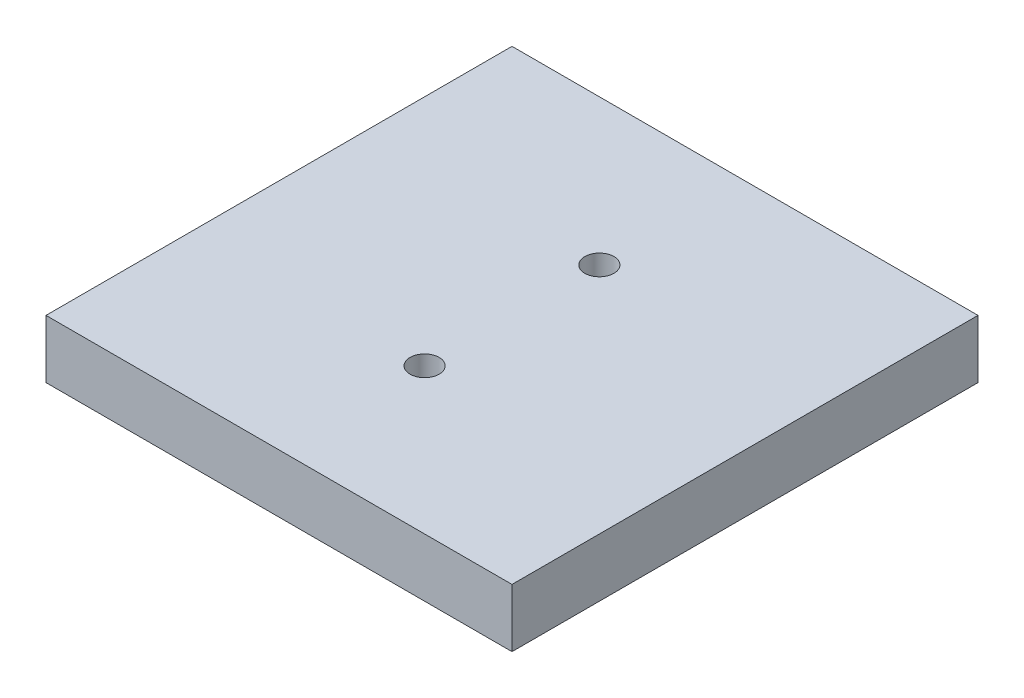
SolidWorks part; units mm, degrees
ref_plane "Plan de face" through (0, 0, 0) normal (0, 0, 1) x (1, 0, 0)
ref_plane "Plan de dessus" through (0, 0, 0) normal (0, 1, 0) x (1, 0, 0)
ref_plane "Plan de droite" through (0, 0, 0) normal (1, 0, 0) x (0, 0, -1)
sketch "Esquisse1" plane through (0, 0, 0) normal (0, 0, 1) x (1, 0, 0)
  line L1 (0, 0) -> (80, 0)
  line L2 (0, 0) -> (0, 10)
  line L3 (0, 10) -> (80, 10)
  line L4 (80, 0) -> (80, 10)
  dimension "D1" = 80
  dimension "D2" = 10
extrude "Extrusion1" add sketch "Esquisse1" along normal blind 80
hole_wizard "Trou taraudé M61" positions "Esquisse3" profile "Esquisse2" tap size "M6" standard "ISO"
sketch "Esquisse3" plane through (0, 10, 0) normal (0, 1, 0) x (-1, 0, 0)
  line L0 (-80, 80) -> (0, 80) construction
  line L1 (0, 80) -> (0, 0) construction
  point P0 (-40, 25)
  point P1 (-40, 55)
  dimension "D1" = 25
  dimension "D2" = 30
  dimension "D3" = 40
sketch "Esquisse2" plane through (40, 10, 25) normal (1, 0, 0) x (0, 0, 1)
  line L0 (0, 0) -> (0, 10)
  line L1 (0, 10) -> (2.5, 10)
  line L2 (2.5, 10) -> (2.5, 0)
  line L5 (2.5, 0) -> (0, 0)
  line L11 (0, -6.35) -> (0, 107.95) construction
  dimension "Diamètre du trou pour taraudage jusqu'au prochain" = 5
  dimension "Profondeur du trou pour taraudage jusqu'au prochain" = 10
